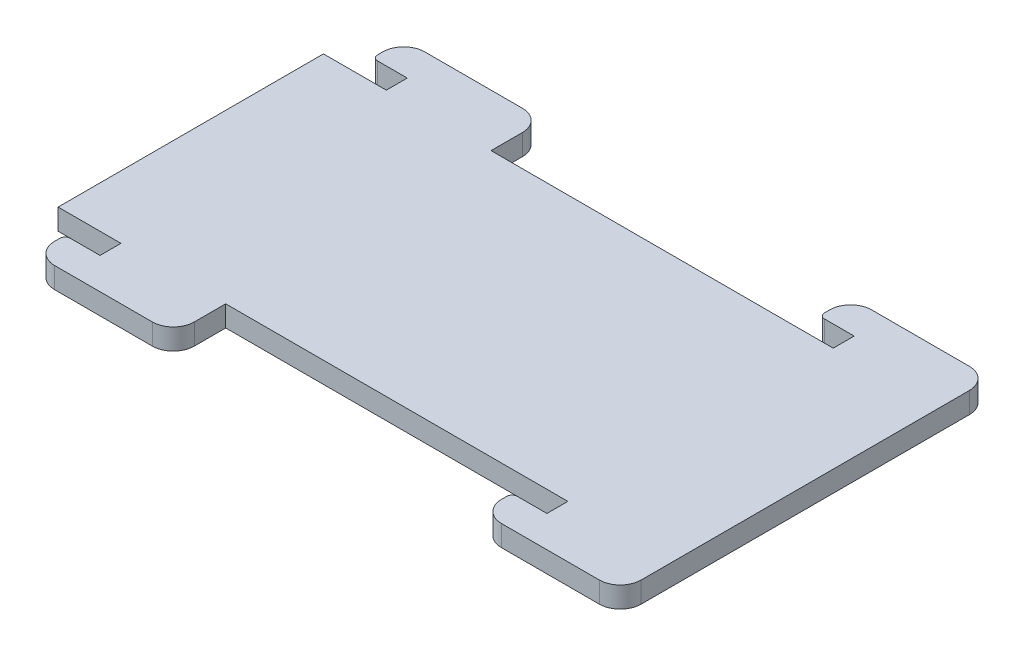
SolidWorks part; units mm, degrees
ref_plane "Front Plane" through (0, 0, 0) normal (0, 0, 1) x (1, 0, 0)
ref_plane "Top Plane" through (0, 0, 0) normal (0, 1, 0) x (1, 0, 0)
ref_plane "Right Plane" through (0, 0, 0) normal (1, 0, 0) x (0, 0, -1)
sketch "Sketch1" plane through (0, 0, 0) normal (0, 1, 0) x (1, 0, 0)
  line L0 (0, 19) -> (88, 19) construction
  line L1 (0, 0) -> (9, 0)
  line L2 (0, 0) -> (0, 38)
  line L3 (0, 38) -> (9, 38)
  line L4 (88, 0) -> (88, 38)
  line L6 (88, 0) -> (88, -3)
  line L8 (73, 0) -> (73, -3)
  line L10 (24, 0) -> (24, -3)
  line L12 (9, 0) -> (9, -3)
  line L13 (73, -3) -> (68, -3)
  line L14 (88, -3) -> (88, -7.5)
  line L15 (88, -7.5) -> (68, -7.5)
  line L16 (68, -3) -> (68, -7.5)
  line L17 (9, -3) -> (4, -3)
  line L18 (24, -3) -> (24, -7.5)
  line L19 (24, -7.5) -> (4, -7.5)
  line L20 (4, -3) -> (4, -7.5)
  line L21 (24, 0) -> (73, 0)
  line L22 (68, 41) -> (68, 45.5)
  line L23 (88, 45.5) -> (68, 45.5)
  line L24 (88, 41) -> (88, 45.5)
  line L25 (73, 41) -> (68, 41)
  line L26 (73, 38) -> (73, 41)
  line L27 (88, 38) -> (88, 41)
  line L28 (4, 41) -> (4, 45.5)
  line L29 (24, 45.5) -> (4, 45.5)
  line L30 (24, 41) -> (24, 45.5)
  line L31 (9, 41) -> (4, 41)
  line L32 (9, 38) -> (9, 41)
  line L33 (24, 38) -> (24, 41)
  line L34 (24, 38) -> (73, 38)
  dimension "D1" = 38
  dimension "D2" = 88
  dimension "D3" = 15
  dimension "D4" = 3
  dimension "D5" = 20
  dimension "D6" = 4.5
  dimension "D7" = 4.5
  dimension "D8" = 3
  dimension "D9" = 15
  dimension "D10" = 20
  dimension "D11" = 44
  dimension "D12" = 3
extrude "Boss-Extrude1" add sketch "Sketch1" along normal blind 3
fillet "Fillet1" radius 3 8 edges at (88, 1.5, 7.5) (68, 1.5, 7.5) (4, 1.5, 7.5) (24, 1.5, 7.5) (4, 1.5, -45.5) (88, 1.5, -45.5) (68, 1.5, -45.5) (24, 1.5, -45.5)
fillet "Fillet2" radius 0.75 4 edges at (68, 1.5, 3) (4, 1.5, 3) (68, 1.5, -41) (4, 1.5, -41)
